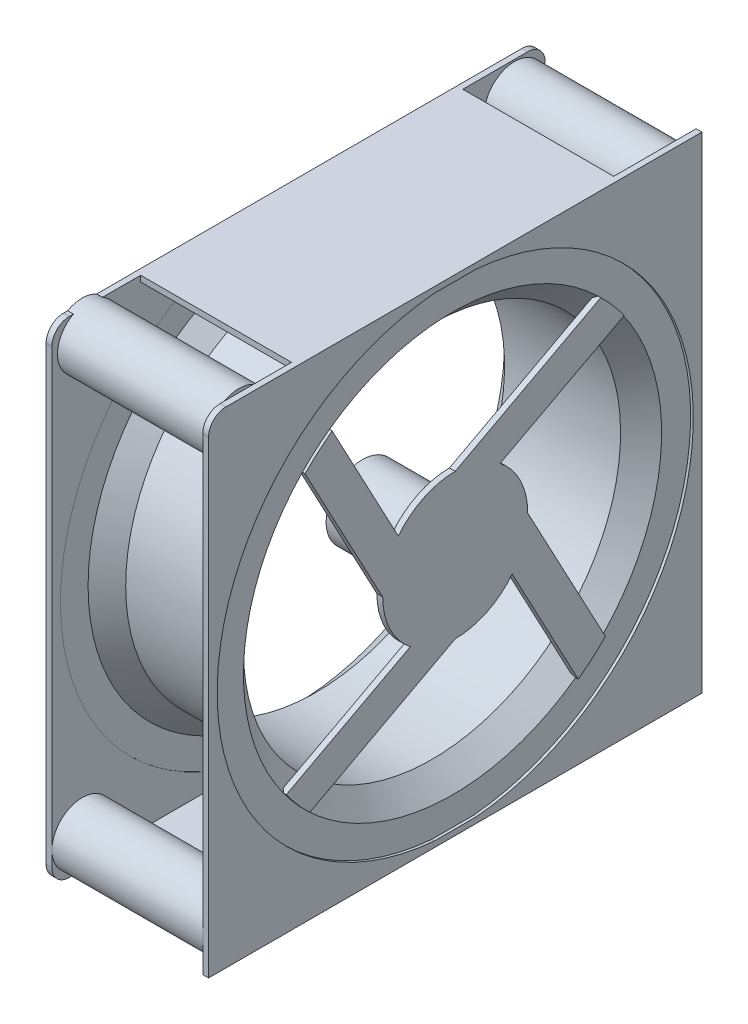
SolidWorks part; units mm, degrees
ref_plane "Front Plane" through (0, 0, 0) normal (0, 0, 1) x (1, 0, 0)
ref_plane "Top Plane" through (0, 0, 0) normal (0, 1, 0) x (1, 0, 0)
ref_plane "Right Plane" through (0, 0, 0) normal (1, 0, 0) x (0, 0, -1)
sketch "Sketch1" plane through (0, 0, 0) normal (0, 1, 0) x (1, 0, 0)
  line L0 (-63.9099, 0) -> (116.8414, 0) construction
  line L1 (0, 0) -> (0, 82.55) construction
  line L2 (-25.4, 82.55) -> (25.4, 82.55)
  line L3 (25.4, 82.55) -> (34.3803, 91.5303)
  line L4 (34.3803, 91.5303) -> (34.3803, 104.2303)
  line L5 (-34.3803, 91.5303) -> (-34.3803, 104.2303)
  line L6 (-25.4, 82.55) -> (-34.3803, 91.5303)
  line L7 (34.3803, 104.2303) -> (-34.3803, 104.2303)
  dimension "D1" = 82.55
  dimension "D2" = 135
  dimension "D3" = 12.7
  dimension "D4" = 25.4
  dimension "D5" = 12.7
revolve "Revolve1" add sketch "Sketch1" angle 360 about L0
shell "Shell1" thickness 1.27
ref_plane "Plane3" through (35.56, 0, 0) normal (1, 0, 0) x (0, 0, -1)
sketch "Sketch9" plane through (35.56, 0, 0) normal (1, 0, 0) x (0, 0, -1)
  circle A0 centre (0, 0) radius 31.75
  circle A2 centre (0, 0) radius 91.5303 construction
  arc A3 (74.5906, 53.0474) -> (63.445, 65.9736) centre (0, 0) ccw
  arc A4 (53.0474, -74.5906) -> (65.9736, -63.445) centre (0, 0) ccw
  arc A5 (-74.5906, -53.0474) -> (-63.445, -65.9736) centre (0, 0) ccw
  arc A6 (-53.0474, 74.5906) -> (-65.9736, 63.445) centre (0, 0) ccw
  spline S0 degree 1 poles (0, 31.75) (63.445, 65.9736) knots 0 0 1 1
  spline S1 degree 1 poles (19.6663, 24.9259) (74.5906, 53.0474) knots 0 0 1 1
  spline S2 degree 1 poles (31.75, 0) (65.9736, -63.445) knots 0 0 1 1
  spline S3 degree 1 poles (24.9259, -19.6663) (53.0474, -74.5906) knots 0 0 1 1
  spline S4 degree 1 poles (0, -31.75) (-63.445, -65.9736) knots 0 0 1 1
  spline S5 degree 1 poles (-19.6663, -24.9259) (-74.5906, -53.0474) knots 0 0 1 1
  spline S6 degree 1 poles (-31.75, 0) (-65.9736, 63.445) knots 0 0 1 1
  spline S7 degree 1 poles (-24.9259, 19.6663) (-53.0474, 74.5906) knots 0 0 1 1
  point P24 (0, 0)
  dimension "D1" = 63.5
  dimension "D2" = 4
extrude "Boss-Extrude6" add sketch "Sketch9" against normal blind 2.54 separate body contours A0 S7
sketch "Sketch10" plane through (35.56, 0, 0) normal (1, 0, 0) x (0, 0, -1)
  circle A0 centre (0, 0) radius 31.75 construction
  circle A1 centre (0, 0) radius 91.5303 construction
  arc A2 (19.6663, 24.9259) -> (0, 31.75) centre (0, 0) ccw
  arc A3 (73.9938, 53.8767) -> (63.6826, 65.7443) centre (0, 0) ccw
  spline S0 degree 1 poles (0, 31.75) (63.6826, 65.7443) knots 0 0 1 1
  spline S1 degree 1 poles (19.6663, 24.9259) (73.9938, 53.8767) knots 0 0 1 1
extrude "Boss-Extrude7" add sketch "Sketch10" against normal blind 2.54
pattern_circular "CirPattern1" count 4 over 360 about axis through (0, 0, 0) along (1, 0, 0) of "Boss-Extrude7"
sketch "Sketch11" plane through (35.56, 0, 0) normal (1, 0, 0) x (0, 0, -1)
  line L1 (-107.9799, 106.3579) -> (107.9799, 106.3579)
  line L2 (-107.9799, 106.3579) -> (-107.9799, -106.3579)
  line L3 (-107.9799, -106.3579) -> (107.9799, -106.3579)
  line L4 (107.9799, 106.3579) -> (107.9799, -106.3579)
  line L5 (-107.9799, 106.3579) -> (107.9799, -106.3579) construction
  line L6 (-107.9799, -106.3579) -> (107.9799, 106.3579) construction
  circle A0 centre (0, 0) radius 104.2303
  point P0 (0, 0)
extrude "Boss-Extrude9" add sketch "Sketch11" against normal blind 2.54
sketch "Sketch12" plane through (33.02, 0, 0) normal (-1, 0, 0) x (0, 0, 1)
  circle A0 centre (0, 0) radius 15.875
  dimension "D1" = 31.75
extrude "Boss-Extrude10" add sketch "Sketch12" along normal blind 38.1
ref_plane "Plane4" through (-35.56, 0, 0) normal (1, 0, 0) x (0, 0, -1)
sketch "Sketch13" plane through (-35.56, 0, 0) normal (1, 0, 0) x (0, 0, -1)
  line L1 (107.9799, 106.3579) -> (-107.9799, 106.3579)
  line L2 (107.9799, 106.3579) -> (107.9799, -106.3579)
  line L3 (107.9799, -106.3579) -> (-107.9799, -106.3579)
  line L4 (-107.9799, 106.3579) -> (-107.9799, -106.3579)
  line L5 (107.9799, 106.3579) -> (-107.9799, -106.3579) construction
  line L6 (107.9799, -106.3579) -> (-107.9799, 106.3579) construction
  circle A0 centre (0, 0) radius 104.2303
  point P0 (0, 0)
extrude "Boss-Extrude11" add sketch "Sketch13" along normal blind 2.54
sketch "Sketch16" plane through (-35.56, 0, 0) normal (-1, 0, 0) x (0, 0, 1)
  circle A0 centre (-94.6418, 92.204) radius 13.3381
extrude "Boss-Extrude12" add sketch "Sketch16" against normal up to surface (68.58 mm away)
pattern_circular "CirPattern3" count 4 over 360 about axis through (0, 0, 0) along (1, 0, 0) of "Boss-Extrude12"
sketch "Sketch17" plane through (35.56, 0, 0) normal (1, 0, 0) x (0, 0, -1)
  line L0 (-50.0834, 106.3579) -> (57.864, 106.3579)
  line L1 (107.9799, 106.3579) -> (-107.9799, 106.3579) construction
sketch "Sketch18" plane through (35.56, 0, 0) normal (1, 0, 0) x (0, 0, -1)
  line L0 (-69.1319, 106.3579) -> (71.9064, 106.3579)
  line L1 (107.9799, 106.3579) -> (-107.9799, 106.3579) construction
  line L2 (71.9064, 106.3579) -> (71.9064, 103.8179)
  line L3 (71.9064, 103.8179) -> (-69.1319, 103.8179)
  line L4 (-69.1319, 103.8179) -> (-69.1319, 106.3579)
  line L5 (-69.1319, 106.3579) -> (-69.1319, 106.1255)
  dimension "D1" = 2.54
extrude "Boss-Extrude13" add sketch "Sketch18" against normal up to surface (68.58 mm away) contours L0 L2 L3 L4
pattern_circular "CirPattern4" count 2 over 360 about axis through (0, 0, 0) along (1, 0, 0) of "Boss-Extrude13"
ref_plane "Plane5" through (-33.02, -106.3579, -85.8292) normal (0, 0.4779, 0.8784) x (1, 0, 0)
sketch "Sketch20" plane through (-35.56, 0, 0) normal (-1, 0, 0) x (0, 0, 1)
  circle A0 centre (-96.2618, 92.8238) radius 7.462
  circle A1 centre (91.5303, 92.8238) radius 7.462
  circle A2 centre (-96.2618, -91.5303) radius 7.462
  circle A3 centre (91.5303, -91.5303) radius 7.462
extrude "Cut-Extrude1" cut sketch "Sketch20" against normal blind 33.02
fillet "Fillet1" radius 2.54 1 edges at (-35.56, 92.8238, -88.7997)
fillet "Fillet2" radius 2.54 3 edges at (-35.56, -91.5303, -88.7997) (-35.56, -91.5303, 98.9923) (-35.56, 92.8238, 98.9923)
fillet "Fillet3" radius 7.62 5 edges at (-34.29, 106.3579, -107.9799) (-34.29, -106.3579, -107.9799) (-34.29, -106.3579, 107.9799) (34.29, 106.3579, 107.9799) (-34.29, 106.3579, 107.9799)
